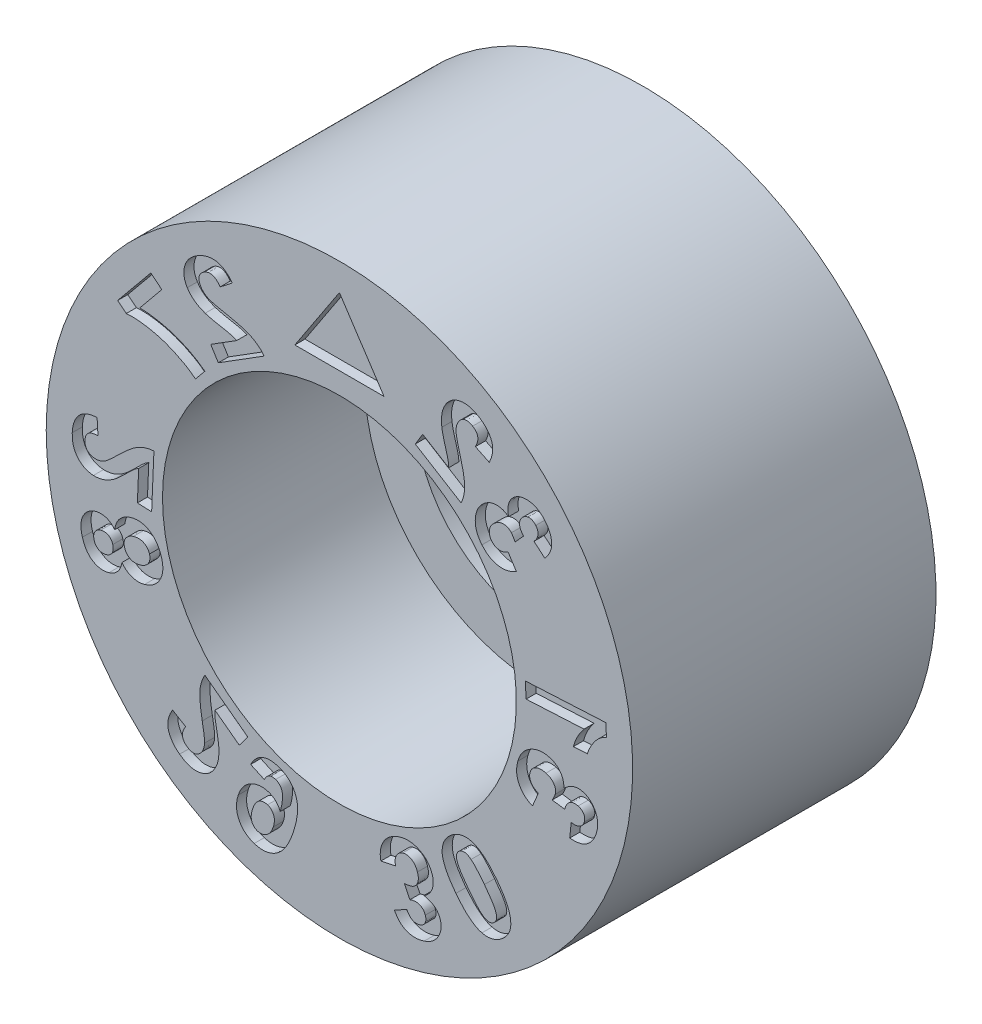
SolidWorks part; units mm, degrees
ref_plane "Front Plane" through (0, 0, 0) normal (0, 0, 1) x (1, 0, 0)
ref_plane "Top Plane" through (0, 0, 0) normal (0, 1, 0) x (1, 0, 0)
ref_plane "Right Plane" through (0, 0, 0) normal (1, 0, 0) x (0, 0, -1)
imported_body "Imported1"
other "Move Face2" parameters "D1"=0.157
other "DeleteFace1"
sketch "Sketch1" plane through (0, 0, 0) normal (0, 0, 1) x (1, 0, 0)
  arc A0 (-0.7207, 1.729) -> (0.7207, 1.729) centre (0, 0) ccw construction
  text T3 "27  28  29  30  31  32" font "Arial" height 0.8
extrude "Cut-Extrude1" cut sketch "Sketch1" against normal blind 0.1
